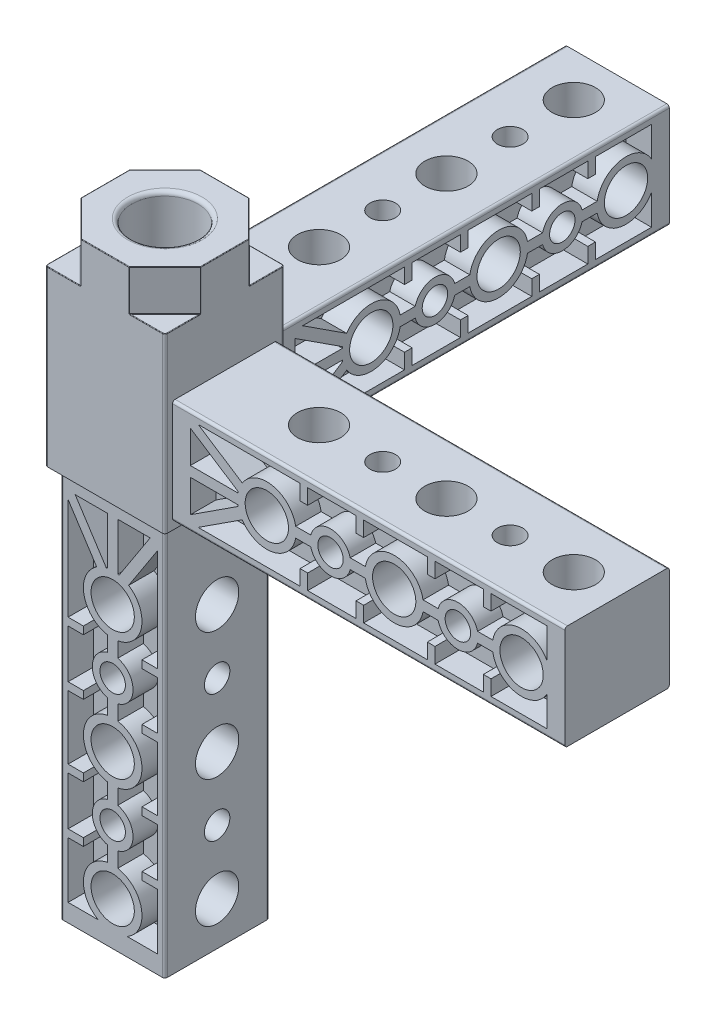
SolidWorks part; units mm, degrees
ref_plane "前视基准面" through (0, 0, 0) normal (0, 0, 1) x (1, 0, 0)
ref_plane "上视基准面" through (0, 0, 0) normal (0, 1, 0) x (1, 0, 0)
ref_plane "右视基准面" through (0, 0, 0) normal (1, 0, 0) x (0, 0, -1)
sketch "草图1" plane through (0, 0, 0) normal (0, 1, 0) x (1, 0, 0)
  line L1 (-11.25, -11.75) -> (11.25, -11.75)
  line L2 (-11.75, -11.25) -> (-11.75, 11.25)
  line L3 (-11.25, 11.75) -> (11.25, 11.75)
  line L4 (11.75, -11.25) -> (11.75, 11.25)
  line L5 (-11.75, -11.75) -> (11.75, 11.75) construction
  line L6 (-11.75, 11.75) -> (11.75, -11.75) construction
  arc A0 (-11.25, -11.75) -> (-11.75, -11.25) centre (-11.25, -11.25) cw
  arc A1 (-11.75, 11.25) -> (-11.25, 11.75) centre (-11.25, 11.25) cw
  arc A2 (11.25, 11.75) -> (11.75, 11.25) centre (11.25, 11.25) cw
  arc A3 (11.25, -11.75) -> (11.75, -11.25) centre (11.25, -11.25) ccw
  point P0 (0, 0)
  dimension "D3" = 0.5
  dimension "D1" = 23.5
  dimension "D2" = 23.5
extrude "拉伸1" add sketch "草图1" along normal blind 42
sketch "草图2" plane through (0, 42, 0) normal (0, 1, 0) x (1, 0, 0)
  line L0 (0, 0) -> (50000, 0) construction
  line L1 (0, 0) -> (0, 50000) construction
  line L2 (-11.25, -11.75) -> (11.25, -11.75) construction
  line L3 (11.75, -11.25) -> (11.75, 11.25) construction
  line L4 (-11.75, 11.25) -> (-11.75, -11.25) construction
  line L5 (11.25, 11.75) -> (-11.25, 11.75) construction
  line L6 (-11.25, -11.75) -> (-4.75, -11.75)
  line L7 (11.75, -11.25) -> (11.75, -4.75)
  line L8 (-11.75, 11.25) -> (-11.75, 4.75)
  line L9 (11.25, 11.75) -> (4.75, 11.75)
  line L10 (-4.75, 11.75) -> (-11.75, 4.75)
  line L11 (4.75, 11.75) -> (11.75, 4.75)
  line L12 (4.75, -11.75) -> (11.75, -4.75)
  line L13 (-4.75, -11.75) -> (-11.75, -4.75)
  line L14 (4.75, -11.75) -> (11.25, -11.75)
  line L15 (-11.75, -4.75) -> (-11.75, -11.25)
  line L16 (11.75, 4.75) -> (11.75, 11.25)
  line L17 (-4.75, 11.75) -> (-11.25, 11.75)
  arc A0 (-11.75, -11.25) -> (-11.25, -11.75) centre (-11.25, -11.25) ccw construction
  arc A1 (11.25, -11.75) -> (11.75, -11.25) centre (11.25, -11.25) ccw construction
  arc A2 (11.75, 11.25) -> (11.25, 11.75) centre (11.25, 11.25) ccw construction
  arc A3 (-11.25, 11.75) -> (-11.75, 11.25) centre (-11.25, 11.25) ccw construction
  arc A4 (-11.75, -11.25) -> (-11.25, -11.75) centre (-11.25, -11.25) ccw
  arc A5 (11.25, -11.75) -> (11.75, -11.25) centre (11.25, -11.25) ccw
  arc A6 (11.75, 11.25) -> (11.25, 11.75) centre (11.25, 11.25) ccw
  arc A7 (-11.25, 11.75) -> (-11.75, 11.25) centre (-11.25, 11.25) ccw
  dimension "D1" = 45
  dimension "D2" = 7
extrude "拉伸2" cut sketch "草图2" against normal blind 8
sketch "草图3" plane through (0, 42, 0) normal (0, 1, 0) x (1, 0, 0)
  circle A0 centre (0, 0) radius 6.5
  dimension "D1" = 13
extrude "拉伸3" cut sketch "草图3" against normal blind 25
fillet "圆角1" radius 0.8 1 edges at (0, 42, 6.5)
fillet "圆角2" radius 0.1 32 edges at (11.75, 38, -4.75) (11.75, 34, -8) (11.6036, 34, 11.6036) (-11.6036, 34, 11.6036) (11.6036, 34, -11.6036) (11.75, 34, 8) (8, 34, 11.75) (-8, 34, 11.75) (-11.75, 34, 8) (8, 34, -11.75) (11.75, 38, 4.75) (8.25, 34, 8.25) (4.75, 38, 11.75) (8.25, 42, 8.25) (-4.75, 38, 11.75) (-8.25, 34, 8.25) (-11.75, 38, 4.75) (-8.25, 42, 8.25) (-11.75, 38, -4.75) (-4.75, 38, -11.75) (-8.25, 42, -8.25) (-8, 34, -11.75) (-8.25, 34, -8.25) (-11.75, 34, -8) (-11.6036, 34, -11.6036) (0, 42, 11.75) (-11.75, 42, 0) (8.25, 34, -8.25) (4.75, 38, -11.75) (0, 42, -11.75) (8.25, 42, -8.25) (11.75, 42, 0)
sketch "草图4" plane through (0, 0, 0) normal (0, -1, 0) x (1, 0, 0)
  line L1 (-9.75, -10.25) -> (9.75, -10.25)
  line L2 (-10.25, -9.75) -> (-10.25, 9.75)
  line L3 (-9.75, 10.25) -> (9.75, 10.25)
  line L4 (10.25, -9.75) -> (10.25, 9.75)
  line L5 (-10.25, -10.25) -> (10.25, 10.25) construction
  line L6 (-10.25, 10.25) -> (10.25, -10.25) construction
  arc A0 (-10.25, 9.75) -> (-9.75, 10.25) centre (-9.75, 9.75) cw
  arc A1 (9.75, 10.25) -> (10.25, 9.75) centre (9.75, 9.75) cw
  arc A2 (9.75, -10.25) -> (10.25, -9.75) centre (9.75, -9.75) ccw
  arc A3 (-9.75, -10.25) -> (-10.25, -9.75) centre (-9.75, -9.75) cw
  point P0 (0, 0)
  dimension "D3" = 0.5
  dimension "D1" = 20.5
  dimension "D2" = 20.5
extrude "拉伸4" add sketch "草图4" along normal blind 77
sketch "草图5" plane through (11.75, 0, 0) normal (1, 0, 0) x (0, 0, -1)
  line L0 (0, 0) -> (0, 41.9) construction
  line L1 (4.7086, 41.9) -> (-4.7086, 41.9) construction
  line L2 (9.75, 0) -> (-9.75, 0) construction
  line L3 (-9.75, 1.5) -> (9.75, 1.5)
  line L4 (-10.25, 2) -> (-10.25, 21.5)
  line L5 (-9.75, 22) -> (9.75, 22)
  line L6 (10.25, 2) -> (10.25, 21.5)
  line L7 (-10.25, 1.5) -> (10.25, 22) construction
  line L8 (-10.25, 22) -> (10.25, 1.5) construction
  arc A0 (-10.25, 21.5) -> (-9.75, 22) centre (-9.75, 21.5) cw
  arc A1 (9.75, 22) -> (10.25, 21.5) centre (9.75, 21.5) cw
  arc A2 (-9.75, 1.5) -> (-10.25, 2) centre (-9.75, 2) cw
  arc A3 (9.75, 1.5) -> (10.25, 2) centre (9.75, 2) ccw
  point P5 (0, 11.75)
  dimension "D4" = 0.5
  dimension "D1" = 1.5
  dimension "D2" = 20.5
  dimension "D3" = 20.5
extrude "拉伸5" add sketch "草图5" along normal blind 77
sketch "草图6" plane through (0, 0, -11.75) normal (0, 0, -1) x (-1, 0, 0)
  line L0 (0, 41.9) -> (0, 0) construction
  line L1 (4.7086, 41.9) -> (-4.7086, 41.9) construction
  line L2 (9.75, 0) -> (-9.75, 0) construction
  line L3 (-9.75, 1.5) -> (9.75, 1.5)
  line L4 (-10.25, 2) -> (-10.25, 21.5)
  line L5 (-9.75, 22) -> (9.75, 22)
  line L6 (10.25, 2) -> (10.25, 21.5)
  line L7 (-10.25, 1.5) -> (10.25, 22) construction
  line L8 (-10.25, 22) -> (10.25, 1.5) construction
  arc A0 (-10.25, 21.5) -> (-9.75, 22) centre (-9.75, 21.5) cw
  arc A1 (-9.75, 1.5) -> (-10.25, 2) centre (-9.75, 2) cw
  arc A2 (9.75, 1.5) -> (10.25, 2) centre (9.75, 2) ccw
  arc A3 (9.75, 22) -> (10.25, 21.5) centre (9.75, 21.5) cw
  point P5 (0, 11.75)
  dimension "D4" = 0.5
  dimension "D1" = 20.5
  dimension "D2" = 20.5
  dimension "D3" = 1.5
extrude "拉伸6" add sketch "草图6" along normal blind 77
sketch "草图9" plane through (0, 0, -10.25) normal (0, 0, -1) x (-1, 0, 0)
  line L0 (-11.75, 2) -> (-11.75, 21.5) construction
sketch_block_instance "块1-2"
sketch_block "块1" parameters "D8"=11.5, "D9"=8, "D20"=5.75, "D21"=4, "D22"=5.75, "D1"=2, "D2"=33, "D3"=2, "D4"=12.5, "D5"=12.5, "D6"=12.5, "D7"=12.5, "D10"=2, "D11"=3, "D12"=1.5, "D13"=9.4789, "D14"=12.5, "D15"=9.5, "D16"=11, "D17"=1.5, "D18"=1.5, "D19"=1.5
extrude "拉伸9" cut sketch "草图9" against normal blind 5
sketch "草图10" plane through (0, 0, 10.25) normal (0, 0, 1) x (1, 0, 0)
  line L0 (11.75, 11.75) -> (-19.8741, 11.75) construction
  line L1 (11.75, 21.5) -> (11.75, 2) construction
sketch_block_instance "块1-4"
extrude "拉伸10" cut sketch "草图10" against normal blind 5
sketch "草图12" plane through (10.25, 0, 0) normal (1, 0, 0) x (0, 0, -1)
  line L0 (13.25, 11.75) -> (-34.3017, 11.75) construction
  line L2 (11.75, 21.5) -> (11.75, 2) construction
sketch_block_instance "块1-6"
extrude "拉伸11" cut sketch "草图12" against normal blind 5
sketch "草图13" plane through (-10.25, 0, 0) normal (-1, 0, 0) x (0, 0, 1)
  line L0 (-11.75, 11.75) -> (27.1926, 11.75) construction
  line L1 (-11.75, 2) -> (-11.75, 21.5) construction
sketch_block_instance "块1-8"
extrude "拉伸12" cut sketch "草图13" against normal blind 5
sketch "草图14"
sketch_block_instance "块2-1"
sketch_block "块2" parameters "D1"=8.5, "D2"=5
extrude "拉伸13" cut sketch "草图14" against normal through all
sketch "草图15" plane through (0, 22, 0) normal (0, 1, 0) x (-1, 0, 0)
  line L0 (-11.75, 0) -> (-98.6653, 0) construction
  line L1 (-11.75, -9.75) -> (-11.75, 9.75) construction
  dimension "D1" = 18.5
sketch_block_instance "块2-3"
extrude "拉伸14" cut sketch "草图15" against normal through all
sketch "草图16" plane through (10.25, 0, 0) normal (1, 0, 0) x (0, 0, -1)
  line L0 (30.25, 11.75) -> (98.0099, 11.75) construction
sketch_block_instance "块2-6"
extrude "拉伸15" cut sketch "草图16" against normal through all
sketch "草图17" plane through (0, 22, 0) normal (0, 1, 0) x (1, 0, 0)
  line L0 (0, 20.841) -> (0, 94.8507) construction
  line L1 (-9.75, 11.75) -> (9.75, 11.75) construction
  dimension "D1" = 18.5
sketch_block_instance "块2-8"
extrude "拉伸16" cut sketch "草图17" against normal through all
sketch "草图19" plane through (0, 0, 10.25) normal (0, 0, 1) x (1, 0, 0)
  line L0 (0, 0) -> (0, -82.054) construction
  line L1 (9.75, 0) -> (-9.75, 0) construction
  dimension "D1" = 18.5
sketch_block_instance "块2-12"
extrude "拉伸18" cut sketch "草图19" against normal through all
sketch "草图20" plane through (0, 0, -10.25) normal (0, 0, -1) x (-1, 0, 0)
  line L0 (0, -18.5) -> (0, -56) construction
sketch_block_instance "块1-9"
extrude "拉伸19" cut sketch "草图20" against normal blind 5
sketch "草图21" plane through (0, 0, 10.25) normal (0, 0, 1) x (1, 0, 0)
  line L0 (0, -18.5) -> (0, -68.5) construction
sketch_block_instance "块1-11"
extrude "拉伸20" cut sketch "草图21" against normal blind 5
sketch "草图22" plane through (-10.25, 0, 0) normal (-1, 0, 0) x (0, 0, 1)
  line L0 (0, 0) -> (0, -53.7529) construction
  line L1 (9.75, 0) -> (-9.75, 0) construction
  dimension "D1" = 18.5
sketch_block_instance "块2-13"
extrude "拉伸21" cut sketch "草图22" against normal through all
